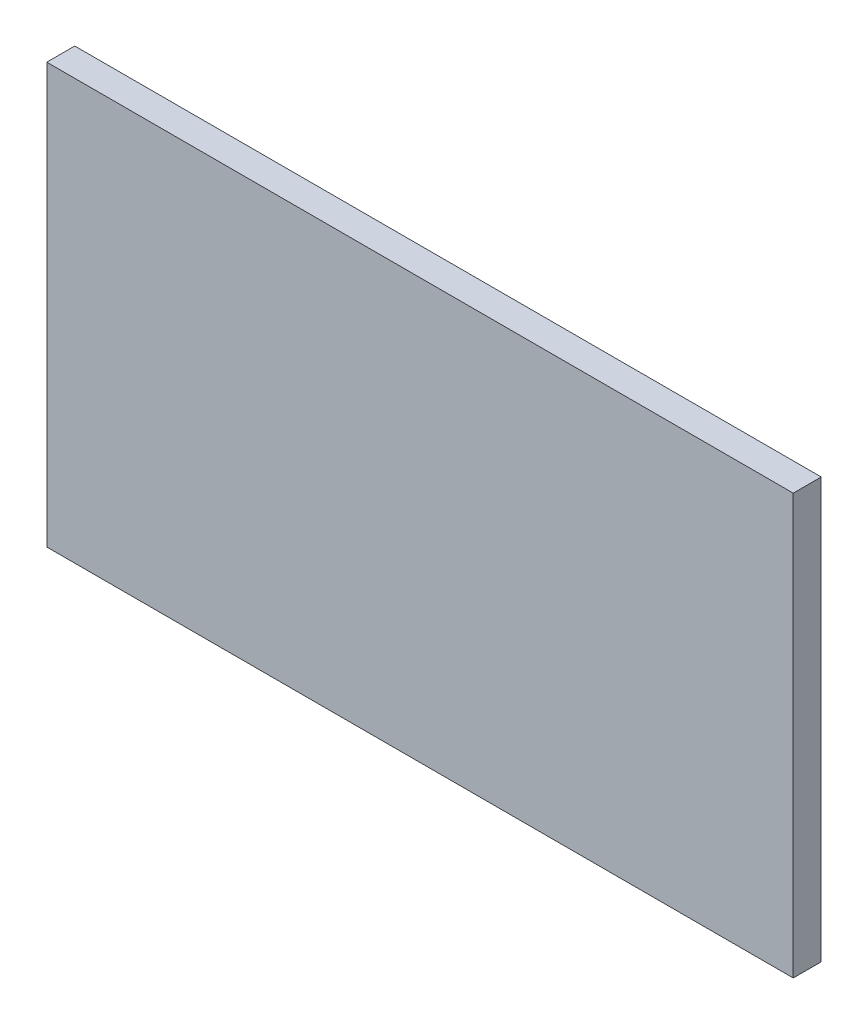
SolidWorks part; units mm, degrees
ref_plane "前视基准面" through (0, 0, 0) normal (0, 0, 1) x (1, 0, 0)
ref_plane "上视基准面" through (0, 0, 0) normal (0, 1, 0) x (1, 0, 0)
ref_plane "右视基准面" through (0, 0, 0) normal (1, 0, 0) x (0, 0, -1)
other "Configuration Table"
sketch "草图2" plane through (0, 0, 0) normal (0, 0, 1) x (1, 0, 0)
  line L6 (0, 0) -> (160, 0)
  line L8 (0, 0) -> (0, 90)
  line L9 (0, 90) -> (160, 90)
  line L10 (160, 0) -> (160, 90)
  dimension "D1" = 160
  dimension "D2" = 90
extrude "凸台-拉伸1" add sketch "草图2" along normal blind 6
